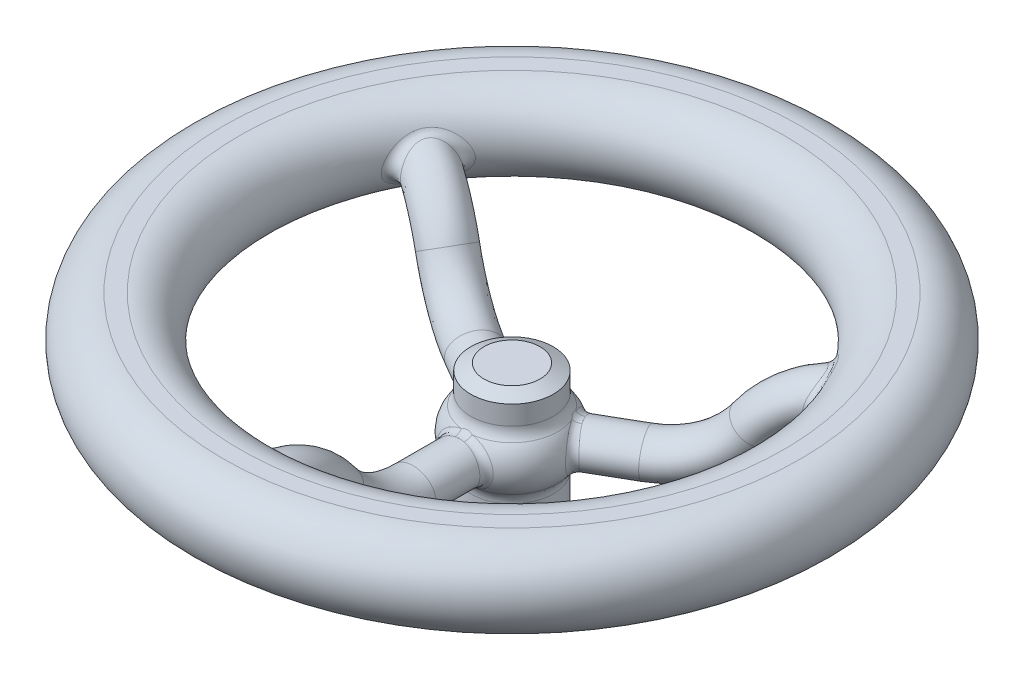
SolidWorks part; units mm, degrees
ref_plane "Front Plane" through (0, 0, 0) normal (0, 0, 1) x (1, 0, 0)
ref_plane "Top Plane" through (0, 0, 0) normal (0, 1, 0) x (1, 0, 0)
ref_plane "Right Plane" through (0, 0, 0) normal (1, 0, 0) x (0, 0, -1)
sketch "Sketch1" plane through (0, 0, 0) normal (1, 0, 0) x (0, 0, -1)
  line L0 (-12.5, 37.198) -> (-12.5, 45)
  line L1 (0, 0) -> (-12.5, 0)
  line L2 (0, 0) -> (0, 45) construction
  line L3 (0, 45) -> (-12.5, 45)
  line L4 (-12.5, 0) -> (-12.5, 16.802)
  line L5 (0, 0) -> (0, 45)
  arc A0 (-13.8333, 33.7987) -> (-13.8333, 20.2013) centre (-6.5, 27) ccw
  arc A1 (-13.8333, 20.2013) -> (-12.5, 16.802) centre (-17.5, 16.802) cw
  arc A2 (-13.8333, 33.7987) -> (-12.5, 37.198) centre (-17.5, 37.198) ccw
  point P10 (-12.5, 19)
  point P13 (-12.5, 35)
  dimension "D6" = 5
  dimension "D1" = 4
  dimension "D2" = 16
  dimension "D3" = 10
  dimension "D4" = 45
  dimension "D5" = 25
revolve "Hub" add sketch "Sketch1" angle 360 about L2
sketch "Sketch2" plane through (0, 0, 0) normal (1, 0, 0) x (0, 0, -1)
  line L0 (-87.5, 51) -> (-82.5, 51) construction
  line L1 (-87.5, 63.5) -> (-82.5, 63.5)
  line L2 (-87.5, 38.5) -> (-82.5, 38.5)
  line L3 (0, 0) -> (0, 63.5) construction
  line L4 (12.5, 45) -> (-12.5, 45) construction
  arc A0 (-87.5, 63.5) -> (-87.5, 38.5) centre (-87.5, 51) ccw
  arc A1 (-82.5, 38.5) -> (-82.5, 63.5) centre (-82.5, 51) ccw
  point P2 (-85, 51)
  dimension "D1" = 25
  dimension "D2" = 30
  dimension "D3" = 170
  dimension "D4" = 6
revolve "Rim" add sketch "Sketch2" angle 360 about L3
sketch "Sketch4" plane through (0, 0, 0) normal (1, 0, 0) x (0, 0, -1)
  line L0 (0, 27) -> (-30, 27)
  line L1 (0, 0) -> (0, 45) construction
  line L2 (-76.9894, 51) -> (-85, 51)
  arc A0 (-30, 27) -> (-53.4947, 39) centre (-30, 56) cw
  arc A1 (-53.4947, 39) -> (-76.9894, 51) centre (-76.9894, 22) ccw
  dimension "D1" = 29
  dimension "D2" = 55
sketch "Sketch5" plane through (0, 0, 0) normal (0, 0, 1) x (1, 0, 0)
  ellipse E0 centre (0, 27) end of major axis (7, 27) minor radius 6
  dimension "D1" = 14
  dimension "D2" = 12
sweep "Spoke" add profiles "Sketch5" path "Sketch4"
pattern_circular "CirPattern1" count 3 over 360 of "Spoke"
fillet "Fillet1" radius 3 6 edges at (16.344, 25.7108, -1.5421) (-6.8365, 25.7108, 14.9253) (-9.5075, 25.7108, -13.3833) (-6.9999, 50.1029, 69.6815) (-57.0989, 48.7407, -40.8483) (63.9251, 48.7407, -29.0249)
chamfer "Chamfer1" distance 4 distance2 2 1 edges at (0, 45, -12.5)
